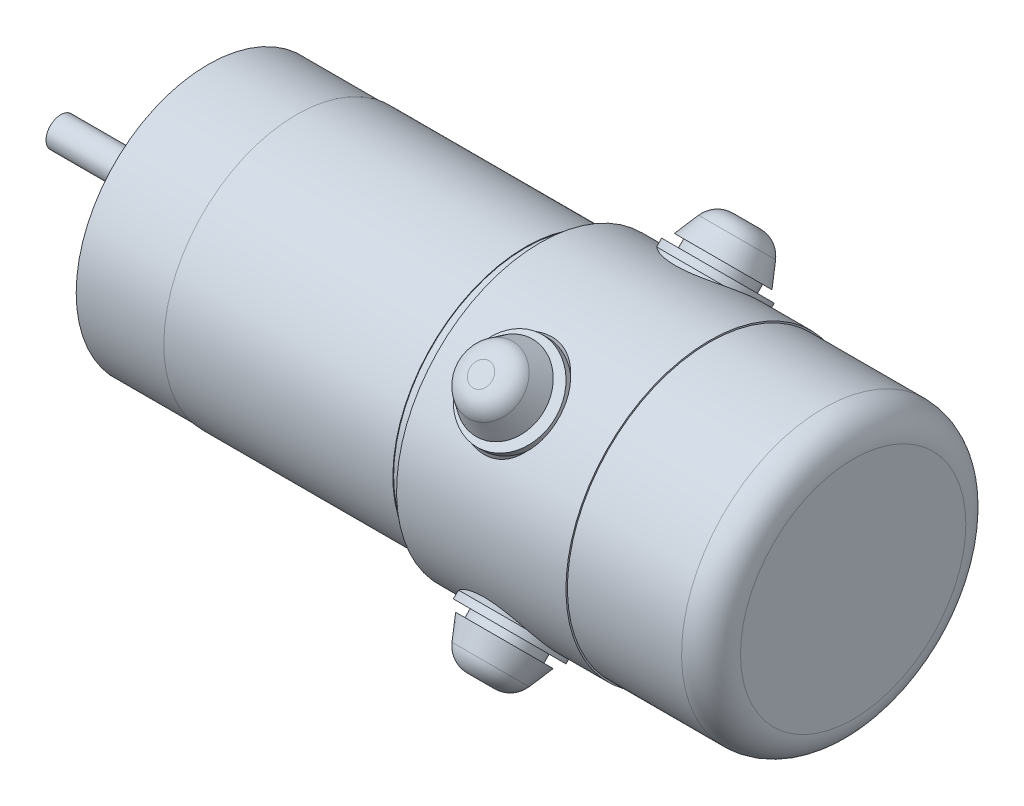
SolidWorks part; units mm, degrees
ref_plane "Plan1" through (0, 0, 0) normal (0, 0, 1) x (1, 0, 0)
ref_plane "Plan2" through (0, 0, 0) normal (0, 1, 0) x (1, 0, 0)
ref_plane "Plan3" through (0, 0, 0) normal (1, 0, 0) x (0, 0, -1)
sketch "Esquisse1" plane through (0, 0, 0) normal (0, 0, 1) x (1, 0, 0)
  line L0 (0, 0) -> (0, 15.3)
  line L1 (-4, 19.3) -> (-19.5, 19.3)
  line L8 (-19.5, 19.3) -> (-19.5, 19.5)
  line L9 (-19.5, 19.5) -> (-42.5, 19.5)
  line L10 (-42.5, 19.5) -> (-42.5, 17.9)
  line L11 (-42.5, 17.9) -> (-44.5, 17.9)
  line L12 (-44.5, 17.9) -> (-44.5, 18)
  line L13 (-44.5, 18) -> (-75.6, 18)
  line L14 (-75.6, 18) -> (-75.6, 17.9)
  line L15 (-75.6, 17.9) -> (-87.6, 17.9)
  line L18 (-87.6, 17.9) -> (-87.6, 9)
  line L19 (0, 0) -> (-126, 0) construction
  line L20 (-87.6, 9) -> (-90.6, 9)
  line L21 (-90.6, 9) -> (-90.6, 1)
  line L22 (-90.6, 1) -> (-83.6, 1)
  line L23 (-83.6, 1) -> (-83.6, 13)
  line L24 (-83.6, 13) -> (-8, 13)
  line L25 (-8, 13) -> (-8, 0)
  line L26 (0, 0) -> (-8, 0)
  arc A0 (0, 15.3) -> (-4, 19.3) centre (-4, 15.3) ccw
  dimension "D19" = 4
  dimension "D1" = 19.3
  dimension "D2" = 19.5
  dimension "D3" = 12
  dimension "D9" = 23
  dimension "D10" = 2
  dimension "D12" = 68.1
  dimension "D13" = 19.5
  dimension "D14" = 18
  dimension "D15" = 17.9
  dimension "D16" = 4
  dimension "D18" = 17.9
  dimension "D20" = 9
  dimension "D21" = 3
  dimension "D22" = 8
  dimension "D23" = 5
  dimension "D24" = 8
revolve "Base-Révolution" add sketch "Esquisse1" angle 360 about L19
sketch "Esquisse2" plane through (-90.6, 0, 0) normal (-1, 0, 0) x (0, 0, 1)
  circle A0 centre (0, 0) radius 2
  dimension "D1" = 4
extrude "Boss.-Extru.1" add sketch "Esquisse2" along normal blind 17
ref_plane "Plan4" through (0, 0, 0) normal (0, 0.7071, 0.7071) x (-1, 0, 0)
ref_plane "Plan5" through (0, 18.0312, 18.0312) normal (0, 0.7071, 0.7071) x (-1, 0, 0)
sketch "Esquisse3" plane through (0, 18.0312, 18.0312) normal (0, 0.7071, 0.7071) x (-1, 0, 0)
  line L0 (0, 0) -> (126, 0) construction
  line L1 (42.5, -19.5) -> (42.5, 19.5) construction
  circle A0 centre (32.5, 0) radius 3.5
  dimension "D1" = 7
  dimension "D2" = 10
extrude "Boss.-Extru.2" add sketch "Esquisse3" against normal up to next draft 23
fillet "Congé1" radius 3
ref_plane "Plan6" through (0, 14.1421, 14.1421) normal (0, 0.7071, 0.7071) x (-1, 0, 0)
sketch "Esquisse4" plane through (0, 14.1421, 14.1421) normal (0, 0.7071, 0.7071) x (-1, 0, 0)
  circle A0 centre (32.5, 0) radius 6.25
  circle A1 centre (32.5, 0) radius 4.2759 construction
  dimension "D1" = 12.5
extrude "Boss.-Extru.3" add sketch "Esquisse4" against normal up to next
sketch "Esquisse5" plane through (0, 14.1421, 14.1421) normal (0, 0.7071, 0.7071) x (-1, 0, 0)
  circle A0 centre (32.5, 0) radius 5.8346
  circle A1 centre (32.5, 0) radius 5.8346 construction
  circle A2 centre (32.5, 0) radius 4.38
  dimension "D1" = 8.76
extrude "Enlèv. mat.-Extru.1" cut sketch "Esquisse5" along normal blind 1
pattern_circular "Répétition circulaire1" count 4 every 90 about axis through (0, 0, 0) along (-1, 0, 0)
hole_wizard "Trou taraudé M4x0.71" positions "Esquisse7" profile "Esquisse6" tap size "M4x0.7" standard "ISO"
sketch "Esquisse7" plane through (-87.6, 0, 0) normal (-1, 0, 0) x (0, 0, 1)
  line L0 (12.994, 12.994) -> (13.4502, 13.4502) construction
  circle A0 centre (0, 0) radius 14 construction
  point P0 (9.8995, 9.8995)
  dimension "D1" = 28
sketch "Esquisse6" plane through (-87.6, 9.8995, 9.8995) normal (0, 1, 0) x (0, 0, 1)
  line L0 (0, 0) -> (0, 9.4914)
  line L1 (0, 9.4914) -> (1.65, 8.5)
  line L2 (1.65, 8.5) -> (1.65, 0)
  line L5 (1.65, 0) -> (0, 0)
  line L10 (0, 9.4914) -> (-1.65, 8.5) construction
  line L11 (0, -6.35) -> (0, 107.95) construction
  dimension "Diamètre du trou pour taraudage" = 3.3
  dimension "Profondeur du trou pour taraudage" = 8.5
  dimension "Angle de pointe" = 118
pattern_circular "Répétition circulaire2" count 4 over 360 about axis through (0, 0, 0) along (-1, 0, 0)
